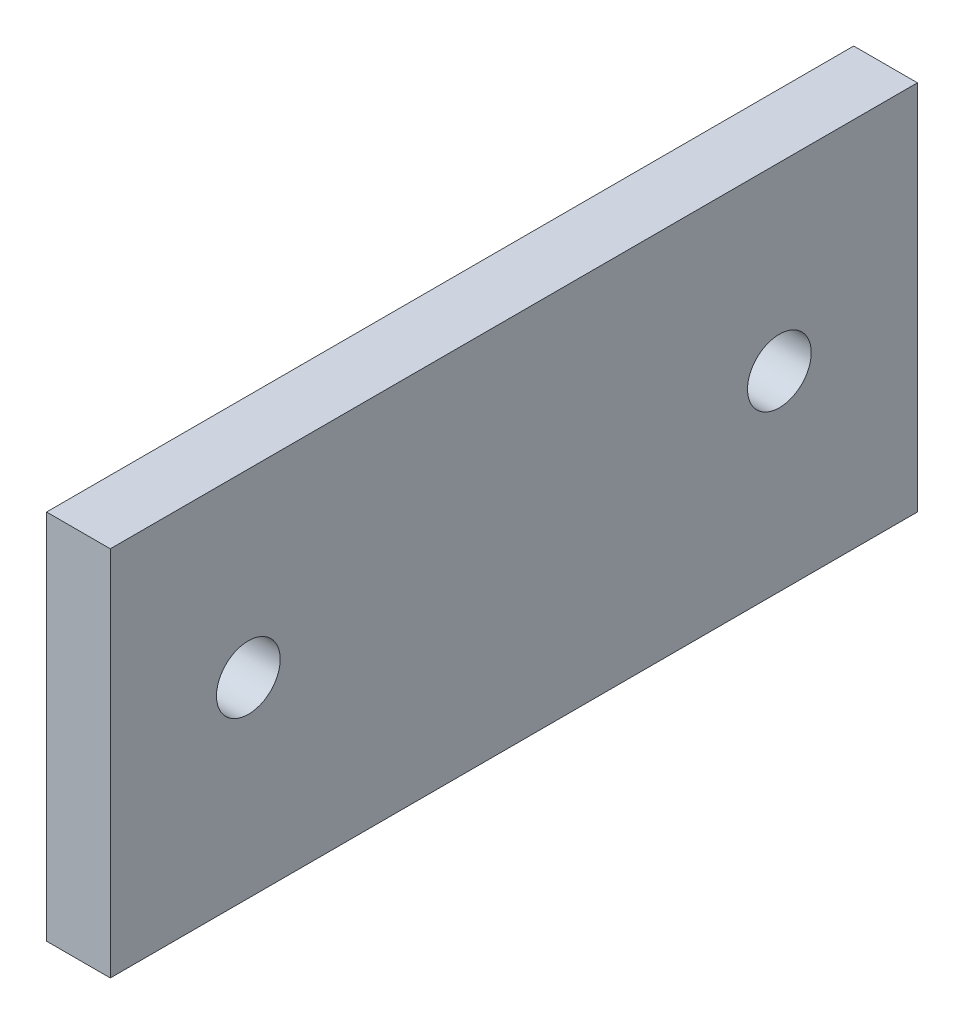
SolidWorks part; units mm, degrees
ref_plane "Front Plane" through (0, 0, 0) normal (0, 0, 1) x (1, 0, 0)
ref_plane "Top Plane" through (0, 0, 0) normal (0, 1, 0) x (1, 0, 0)
ref_plane "Right Plane" through (0, 0, 0) normal (1, 0, 0) x (0, 0, -1)
sketch "Sketch1" plane through (0, 0, 0) normal (1, 0, 0) x (0, 0, -1)
  line L0 (0, 0) -> (0, 50000) construction
  line L1 (-38, -17.5) -> (38, -17.5)
  line L2 (-38, -17.5) -> (-38, 17.5)
  line L3 (-38, 17.5) -> (38, 17.5)
  line L4 (38, -17.5) -> (38, 17.5)
  line L5 (-38, -17.5) -> (38, 17.5) construction
  line L6 (-38, 17.5) -> (38, -17.5) construction
  line L7 (0, 0) -> (50000, 0) construction
  circle A0 centre (25, 0.5) radius 3
  circle A1 centre (-25, 0.5) radius 3
  point P0 (0, 0)
  dimension "D3" = 6
  dimension "D1" = 76
  dimension "D2" = 35
  dimension "D4" = 18
  dimension "D5" = 13
extrude "Boss-Extrude1" add sketch "Sketch1" along normal mid plane 6
